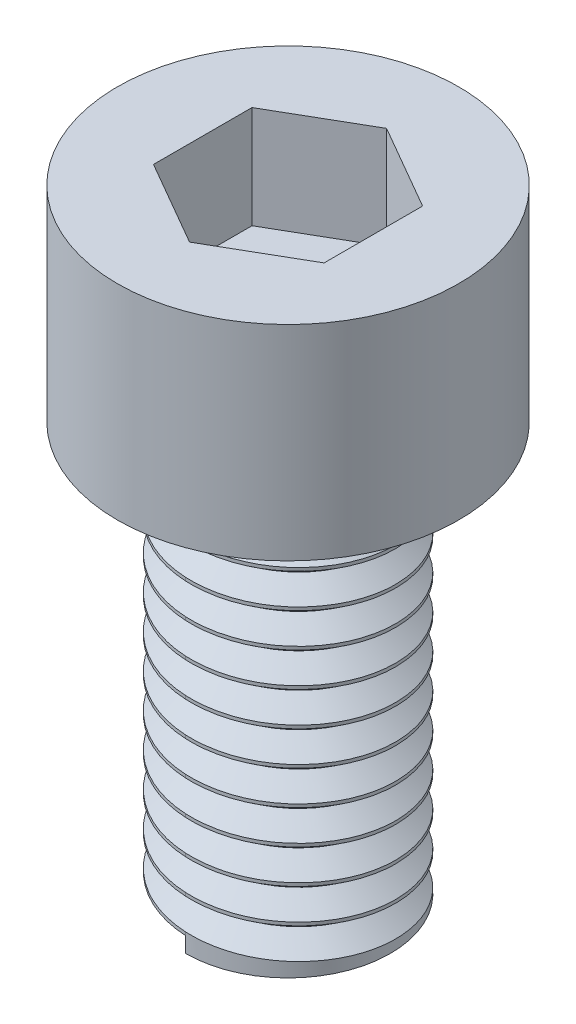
SolidWorks part; units mm, degrees
ref_plane "Alzado" through (0, 0, 0) normal (0, 0, 1) x (1, 0, 0)
ref_plane "Planta" through (0, 0, 0) normal (0, 1, 0) x (1, 0, 0)
ref_plane "Vista lateral" through (0, 0, 0) normal (1, 0, 0) x (0, 0, -1)
sketch "Sk_Cabeza" plane through (0, 0, 0) normal (0, 1, 0) x (1, 0, 0)
  circle A0 centre (0, 0) radius 5
  dimension "DIAM1" = 10
extrude "Cabeza" add sketch "Sk_Cabeza" along normal blind 6 from offset 0
sketch "Sk_Cana" plane through (0, 0, 0) normal (0, 1, 0) x (1, 0, 0)
  circle A0 centre (0, 0) radius 3
  dimension "DIAM2" = 6
extrude "Cana" add sketch "Sk_Cana" along normal blind 12 from offset 12
ref_plane "Plano_cabeza" through (0, 6, 0) normal (0, 1, 0) x (1, 0, 0)
sketch "Sk_Hueco_Allen" plane through (0, 6, 0) normal (0, 1, 0) x (1, 0, 0)
  line L0 (2.5, -1.4434) -> (0, -2.8868)
  line L1 (0, -2.8868) -> (-2.5, -1.4434)
  line L2 (-2.5, -1.4434) -> (-2.5, 1.4434)
  line L3 (-2.5, 1.4434) -> (0, 2.8868)
  line L4 (0, 2.8868) -> (2.5, 1.4434)
  line L5 (2.5, 1.4434) -> (2.5, -1.4434)
extrude "Hueco_Allen" cut sketch "Sk_Hueco_Allen" against normal blind 3
ref_plane "Plano_punta" through (0, -12, 0) normal (0, 1, 0) x (1, 0, 0)
sketch "Sk_Helice" plane through (0, -12, 0) normal (0, 1, 0) x (1, 0, 0)
  circle A0 centre (0, 0) radius 3
curve "Helice_rosca"
sketch "Sk_Perfil_rosca" plane through (0, 0, 0) normal (1, 0, 0) x (0, 0, -1)
  line L0 (-3.2, -12.6) -> (-2.3866, -12)
  line L1 (-2.3866, -12) -> (-3.2, -11.4)
  line L2 (-3.2, -11.4) -> (-3.2, -12.6)
sweep "Rosca_M6x1,0" cut profiles "Sk_Perfil_rosca" path "Helice_rosca"
